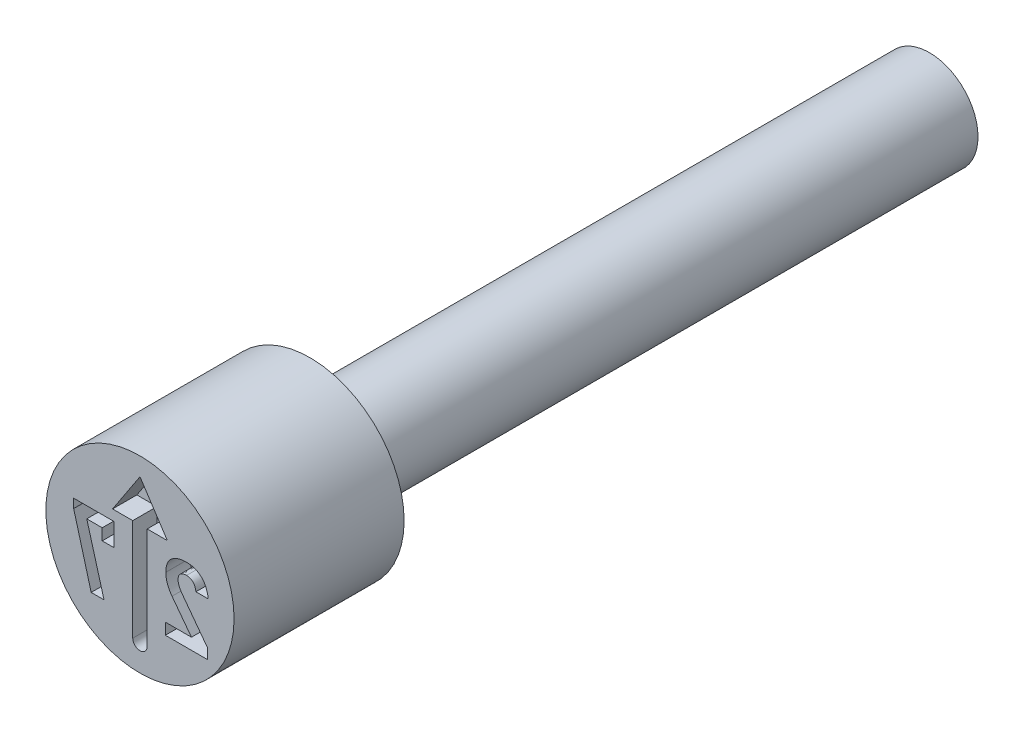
SolidWorks part; units mm, degrees
ref_plane "Front Plane" through (0, 0, 0) normal (0, 0, 1) x (1, 0, 0)
ref_plane "Top Plane" through (0, 0, 0) normal (0, 1, 0) x (1, 0, 0)
ref_plane "Right Plane" through (0, 0, 0) normal (1, 0, 0) x (0, 0, -1)
sketch "Sketch2" plane through (0, 0, 0) normal (1, 0, 0) x (0, 0, -1)
  line L0 (0.4039, 0) -> (50000.4039, 0) construction
  line L6 (0, 1.55) -> (0, 0)
  line L7 (2.8, 1.55) -> (0, 1.55)
  line L8 (2.8, 0.8) -> (2.8, 1.55)
  line L9 (13, 0.8) -> (2.8, 0.8)
  line L10 (13, 0) -> (13, 0.8)
  line L11 (0, 0) -> (13, 0)
  dimension "D1" = 3.1
  dimension "D2" = 1.6
  dimension "D3" = 13
  dimension "D4" = 2.8
revolve "Revolve1" add sketch "Sketch2" angle 360 about L0
sketch "Sketch3" plane through (0, 0, 0) normal (0, 0, 1) x (1, 0, 0)
  line L0 (0, 0) -> (0, 62500) construction
  line L1 (0.119, 0.5665) -> (0.119, -1.1101)
  line L2 (0.4512, 0.5665) -> (0.119, 0.5665)
  line L3 (0, 1.2513) -> (0.4512, 0.5665)
  line L15 (0, 1.2513) -> (-0.4512, 0.5665)
  line L16 (-0.4512, 0.5665) -> (-0.119, 0.5665)
  line L17 (-0.119, 0.5665) -> (-0.119, -1.1101)
  arc A2 (-0.119, -1.1101) -> (0.119, -1.1101) centre (0, -1.1101) ccw
extrude "Cut-Extrude4" cut sketch "Sketch3" against normal blind 0.4
sketch "Sketch4" plane through (0, 0, 0) normal (0, 0, 1) x (1, 0, 0)
  text T0 "2  7" font "Bahnschrift SemiBold" height 1.2
  dimension "D1" = 0.8
extrude "Cut-Extrude5" cut sketch "Sketch4" against normal blind 0.4
